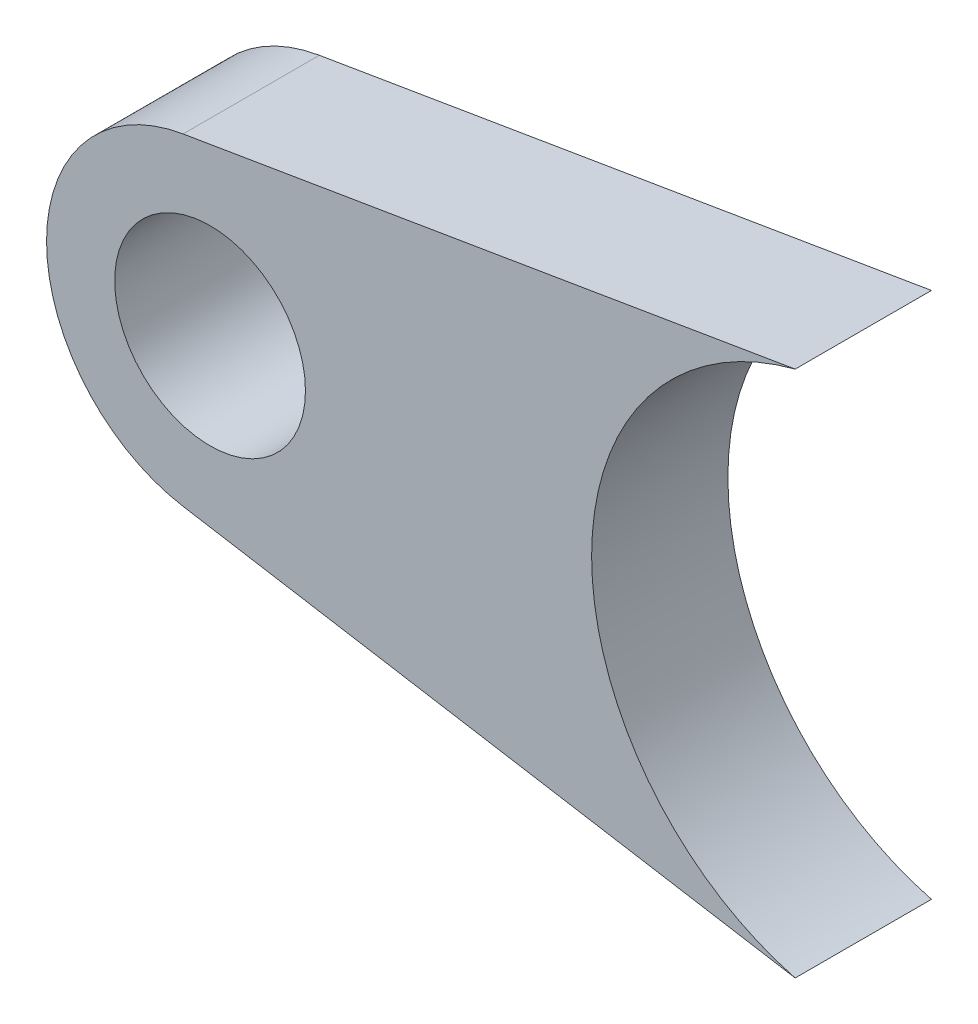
SolidWorks part; units mm, degrees
ref_plane "前视基准面" through (0, 0, 0) normal (0, 0, 1) x (1, 0, 0)
ref_plane "上视基准面" through (0, 0, 0) normal (0, 1, 0) x (1, 0, 0)
ref_plane "右视基准面" through (0, 0, 0) normal (1, 0, 0) x (0, 0, -1)
sketch "草图1" plane through (0, 0, 0) normal (0, 0, 1) x (1, 0, 0)
  line L0 (-12.6531, 48.3725) -> (-124.9493, 29.5889)
  line L1 (-124.9493, -29.5889) -> (-12.6531, -48.3725)
  line L2 (0, 0) -> (-68.6457, 0) construction
  arc A0 (-12.6531, 48.3725) -> (-12.6531, -48.3725) centre (0, 0) ccw
  arc A1 (-124.9493, 29.5889) -> (-124.9493, -29.5889) centre (-120, 0) ccw
  circle A2 centre (-120, 0) radius 17.5
  dimension "D1" = 50
  dimension "D3" = 30
  dimension "D4" = 35
  dimension "D2" = 120
extrude "拉伸1" add sketch "草图1" along normal blind 25
